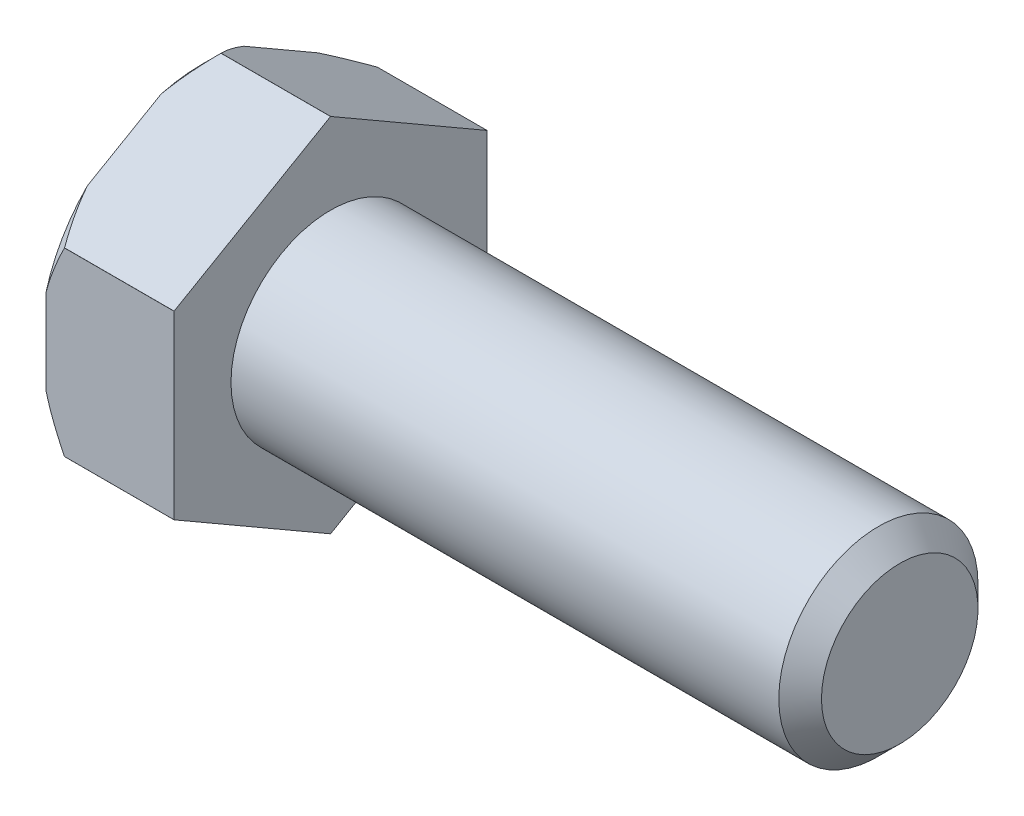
SolidWorks part; units mm, degrees
ref_plane "Plan1" through (0, 0, 0) normal (0, 0, 1) x (1, 0, 0)
ref_plane "Plan2" through (0, 0, 0) normal (0, 1, 0) x (1, 0, 0)
ref_plane "Plan3" through (0, 0, 0) normal (1, 0, 0) x (0, 0, -1)
sketch "Esquisse1" plane through (0, 0, 0) normal (0, 0, 1) x (1, 0, 0)
  line L0 (-49.2335, 0) -> (51.0797, 0) construction
  line L1 (-9, 0) -> (-9, 12.7)
  line L2 (-9, 12.7) -> (0, 12.7)
  line L3 (0, 12.7) -> (0, 7)
  line L4 (0, 7) -> (40, 7)
  line L5 (40, 7) -> (40, 0)
  line L6 (-9, 0) -> (40, 0)
  dimension "D1" = 7
  dimension "D2" = 9
  dimension "D3" = 9
  dimension "D4" = 40
  dimension "D5" = 12.7
revolve "Base-Révolution" add sketch "Esquisse1"
chamfer "Chanfrein2" distance 1.5 angle 45
chamfer "Chanfrein1" distance 1.3 angle 45
sketch "Esquisse2" plane through (-9, 0, 0) normal (-1, 0, 0) x (0, 0, 1)
  line L0 (-11, 6.3509) -> (0, 12.7017)
  line L1 (0, 12.7017) -> (11, 6.3509)
  line L2 (11, 6.3509) -> (11, -6.3509)
  line L3 (0, -12.7017) -> (11, -6.3509)
  line L4 (-11, -6.3509) -> (0, -12.7017)
  line L11 (-11, 6.3509) -> (-11, -6.3509)
extrude "Enlèv. mat.-Extru.1" cut sketch "Esquisse2" against normal through all flip side to cut
